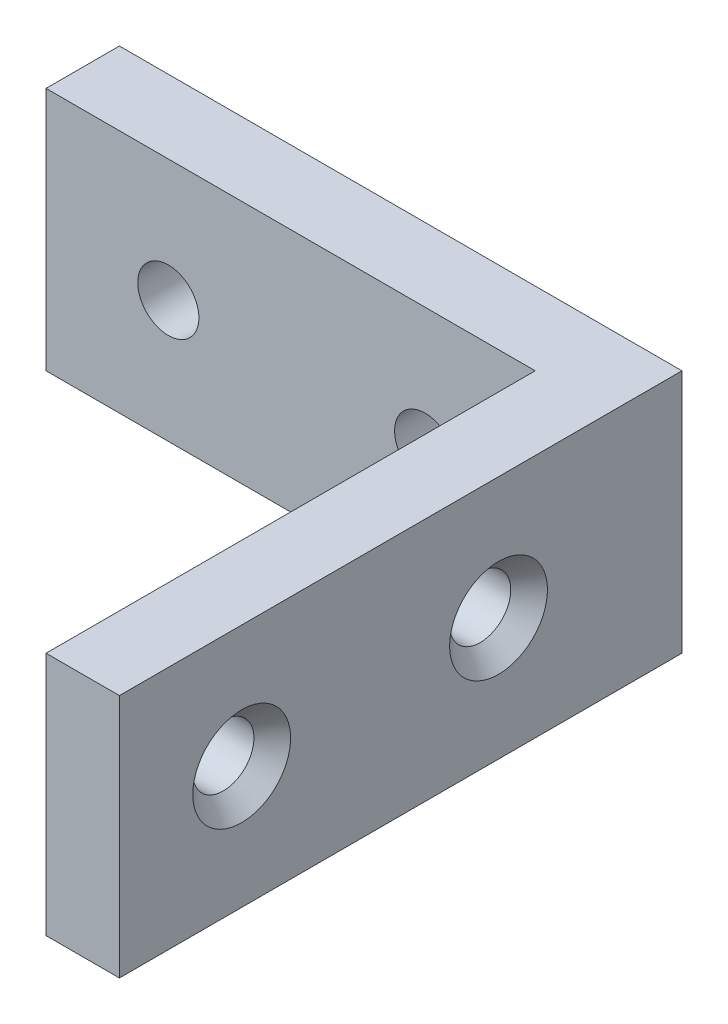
SolidWorks part; units mm, degrees
ref_plane "Plan de face" through (0, 0, 0) normal (0, 0, 1) x (1, 0, 0)
ref_plane "Plan de dessus" through (0, 0, 0) normal (0, 1, 0) x (1, 0, 0)
ref_plane "Plan de droite" through (0, 0, 0) normal (1, 0, 0) x (0, 0, -1)
sketch "Esquisse2" plane through (0, 0, 0) normal (0, 1, 0) x (1, 0, 0)
  line L0 (0, 0) -> (40, 0)
  line L1 (40, 0) -> (40, -40)
  line L2 (0, 6) -> (46, 6)
  line L3 (46, 6) -> (46, -40)
  line L4 (0, 6) -> (0, 0)
  line L5 (40, -40) -> (46, -40)
  dimension "D1" = 40
  dimension "D2" = 6
extrude "Boss.-Extru.1" add sketch "Esquisse2" along normal blind 20
sketch "Esquisse3" plane through (46, 0, 0) normal (1, 0, 0) x (0, 0, -1)
  line L0 (6, 20) -> (6, 0) construction
  line L1 (-40, 20) -> (-40, 0) construction
  line L2 (-40, 0) -> (6, 0) construction
  circle A0 centre (-30, 10) radius 2.5
  circle A1 centre (-9, 10) radius 2.5
  point P8 (0, 0)
  point P9 (0, 0)
  dimension "D1" = 5
  dimension "D2" = 15
  dimension "D3" = 10
  dimension "D4" = 10
extrude "Enlèv. mat.-Extru.1" cut sketch "Esquisse3" against normal up to next
sketch "Esquisse4" plane through (0, 0, -6) normal (0, 0, -1) x (-1, 0, 0)
  line L0 (0, 20) -> (0, 0) construction
  line L1 (-46, 20) -> (-46, 0) construction
  line L2 (-46, 20) -> (0, 20) construction
  circle A0 centre (-10, 10) radius 2.5
  circle A1 centre (-31, 10) radius 2.5
  point P8 (0, 0)
  dimension "D1" = 5
  dimension "D2" = 5
  dimension "D3" = 10
  dimension "D5" = 10
  dimension "D4" = 15
extrude "Enlèv. mat.-Extru.2" cut sketch "Esquisse4" against normal blind 20
chamfer "Chanfrein1" distance 1.5 angle 45 4 edges at (46, 10, 27.5) (46, 10, 6.5) (28.5, 10, -6) (7.5, 10, -6)
